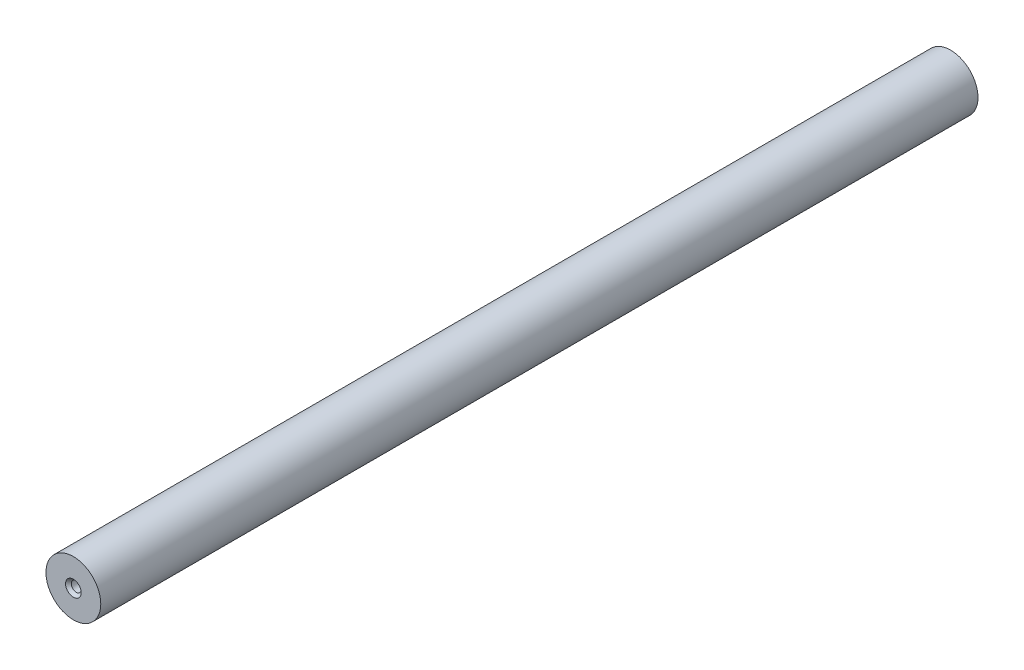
SolidWorks part; units mm, degrees
ref_plane "Front Plane" through (0, 0, 0) normal (0, 0, 1) x (1, 0, 0)
ref_plane "Top Plane" through (0, 0, 0) normal (0, 1, 0) x (1, 0, 0)
ref_plane "Right Plane" through (0, 0, 0) normal (1, 0, 0) x (0, 0, -1)
sketch "Sketch1" plane through (0, 0, 0) normal (0, 0, 1) x (1, 0, 0)
  circle A0 centre (-17.8567, 5.7068) radius 9.525
extrude "Boss-Extrude1" add sketch "Sketch1" against normal blind 304.8
hole_wizard "#8-32 Tapped Hole1" positions "Sketch2" profile "Sketch3" tap size "#8-32" standard "ANSI Inch"
sketch "Sketch2" plane through (0, 0, 0) normal (0, 0, 1) x (1, 0, 0)
  circle A0 centre (-17.8567, 5.7068) radius 9.525 construction
  point P0 (-17.8567, 5.7068)
  dimension "D1" = 0
  dimension "D2" = 0
sketch "Sketch3" plane through (-17.8567, 5.7068, 0) normal (1, 0, 0) x (0, -1, 0)
  line L0 (0, 0) -> (0, 13.7378)
  line L1 (0, 13.7378) -> (1.7272, 12.7)
  line L2 (1.7272, 12.7) -> (1.7272, 0.9906)
  line L3 (1.7272, 0.9906) -> (2.7178, 0)
  line L5 (2.7178, 0) -> (0, 0)
  line L6 (-1.7272, 0.9906) -> (-2.7178, 0) construction
  line L10 (0, 13.7378) -> (-1.7272, 12.7) construction
  line L11 (0, -6.35) -> (0, 107.95) construction
  dimension "Tap Drill Dia." = 3.4544
  dimension "Tap Drill Depth" = 12.7
  dimension "Near C'Sink Dia." = 5.4356
  dimension "Near C'Sink Angle" = 90
  dimension "Drill Angle" = 118
hole_wizard "#8-32 Tapped Hole2" positions "Sketch6" profile "Sketch7" tap size "#8-32" standard "ANSI Inch"
sketch "Sketch6" plane through (0, 0, -304.8) normal (0, 0, -1) x (-1, 0, 0)
  circle A0 centre (17.8567, 5.7068) radius 9.525 construction
  point P0 (17.8567, 5.7068)
  dimension "D1" = 0
sketch "Sketch7" plane through (-17.8567, 5.7068, -304.8) normal (1, 0, 0) x (0, 1, 0)
  line L0 (0, 0) -> (0, 13.7378)
  line L1 (0, 13.7378) -> (1.7272, 12.7)
  line L2 (1.7272, 12.7) -> (1.7272, 0.9906)
  line L3 (1.7272, 0.9906) -> (2.7178, 0)
  line L5 (2.7178, 0) -> (0, 0)
  line L6 (-1.7272, 0.9906) -> (-2.7178, 0) construction
  line L10 (0, 13.7378) -> (-1.7272, 12.7) construction
  line L11 (0, -6.35) -> (0, 107.95) construction
  dimension "Tap Drill Dia." = 3.4544
  dimension "Tap Drill Depth" = 12.7
  dimension "Near C'Sink Dia." = 5.4356
  dimension "Near C'Sink Angle" = 90
  dimension "Drill Angle" = 118
